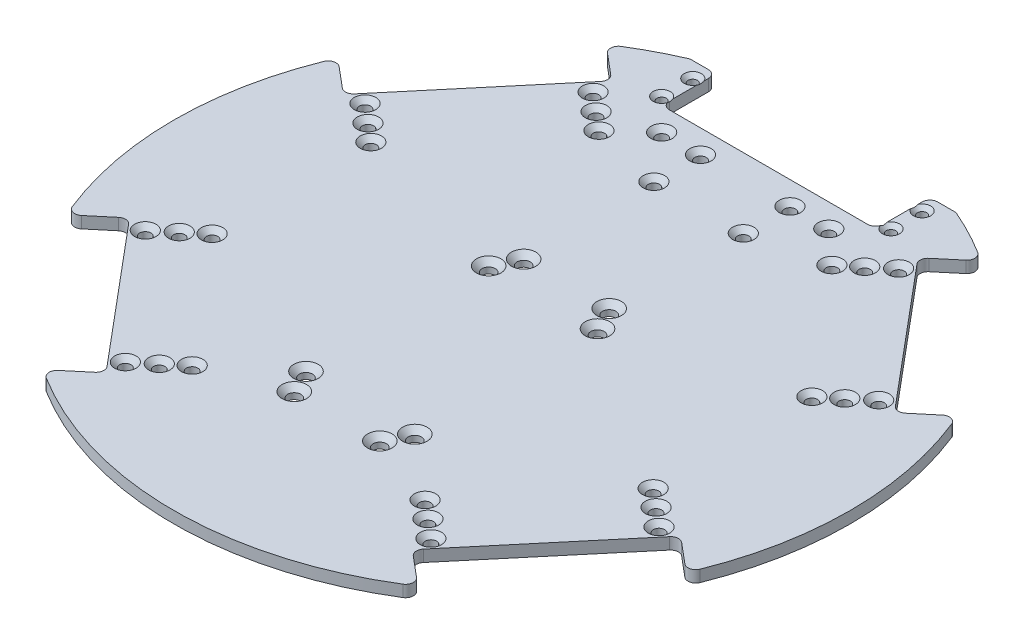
SolidWorks part; units mm, degrees
ref_plane "Plano frontal" through (0, 0, 0) normal (0, 0, 1) x (1, 0, 0)
ref_plane "Plano superior" through (0, 0, 0) normal (0, 1, 0) x (1, 0, 0)
ref_plane "Plano direito" through (0, 0, 0) normal (1, 0, 0) x (0, 0, -1)
sketch "Esboço1" plane through (0, 0, 0) normal (0, 1, 0) x (1, 0, 0)
  line L0 (0, 0) -> (0, 57.579) construction
  line L1 (0, 0) -> (28.8198, 0) construction
  circle A0 centre (0, 0) radius 87
  dimension "D1" = 174
extrude "Ressalto-extrusão2" add sketch "Esboço1" along normal blind 3
sketch "Esboço2" plane through (0, 3, 0) normal (0, 1, 0) x (1, 0, 0)
  line L0 (-87, 0) -> (87, 0) construction
  line L1 (0, 0) -> (66.6459, 55.9225) construction
  line L2 (0, 0) -> (66.6459, -55.9225) construction
  line L3 (48.2004, 72.4274) -> (79.697, 34.8912) construction
  line L4 (39.3908, 65.0353) -> (70.8874, 27.4991)
  line L9 (70.8874, 27.4991) -> (82.3942, 37.1544)
  line L10 (66.6459, 55.9225) -> (82.3942, 37.1544)
  line L11 (66.6459, 55.9225) -> (50.8976, 74.6906)
  line L12 (39.3908, 65.0353) -> (50.8976, 74.6906)
  line L13 (50.8976, -74.6906) -> (82.3942, -37.1544)
  line L14 (50.8976, -74.6906) -> (39.3908, -65.0353)
  line L15 (39.3908, -65.0353) -> (70.8874, -27.4991)
  line L16 (70.8874, -27.4991) -> (82.3942, -37.1544)
  line L17 (0, -87) -> (0, 87) construction
  line L18 (-39.3908, -65.0353) -> (-70.8874, -27.4991)
  line L19 (-50.8976, -74.6906) -> (-82.3942, -37.1544)
  line L20 (-50.8976, -74.6906) -> (-39.3908, -65.0353)
  line L21 (-70.8874, -27.4991) -> (-82.3942, -37.1544)
  line L22 (-66.6459, 55.9225) -> (-82.3942, 37.1544)
  line L23 (-70.8874, 27.4991) -> (-82.3942, 37.1544)
  line L24 (-48.2004, 72.4274) -> (-79.697, 34.8912) construction
  line L25 (-39.3908, 65.0353) -> (-50.8976, 74.6906)
  line L26 (-66.6459, 55.9225) -> (-50.8976, 74.6906)
  line L27 (-39.3908, 65.0353) -> (-70.8874, 27.4991)
  line L28 (48.2004, -72.4274) -> (79.697, -34.8912) construction
  circle A0 centre (0, 0) radius 87 construction
  point P11 (63.9487, 53.6593)
  point P12 (55.1391, 46.2672)
  point P20 (66.6459, -55.9225)
  point P28 (-66.6459, -55.9225)
  dimension "D1" = 40
  dimension "D2" = 40
  dimension "D3" = 49
  dimension "D4" = 11.5
  dimension "D5" = 49
  dimension "D6" = 49
  dimension "D7" = 11.5
extrude "Corte-extrusão2" cut sketch "Esboço2" against normal blind 3
fillet "Filete1" radius 2 16 edges at (-48.2004, 1.5, 72.4274) (-39.3908, 1.5, 65.0353) (-70.8874, 1.5, 27.4991) (-79.697, 1.5, 34.8912) (-79.697, 1.5, -34.8912) (-70.8874, 1.5, -27.4991) (-39.3908, 1.5, -65.0353) (-48.2004, 1.5, -72.4274) (48.2004, 1.5, -72.4274) (39.3908, 1.5, -65.0353) (70.8874, 1.5, -27.4991) (79.697, 1.5, -34.8912) (79.697, 1.5, 34.8912) (70.8874, 1.5, 27.4991) (39.3908, 1.5, 65.0353) (48.2004, 1.5, 72.4274)
sketch "Esboço3" plane through (0, 3, 0) normal (0, 1, 0) x (1, 0, 0)
  line L0 (0, 0) -> (-55.1391, 46.2672) construction
  line L1 (-69.6019, 29.0312) -> (-40.6764, 63.5032) construction
  line L2 (0, 0) -> (-55.1391, -46.2672) construction
  line L4 (-40.6764, -63.5032) -> (-69.6019, -29.0312) construction
  line L6 (0, 87) -> (0, -87) construction
  line L7 (-68.5252, -30.3144) -> (-41.7531, -62.2201) construction
  line L8 (-41.7531, -62.2201) -> (-29.956, -52.3212) construction
  line L9 (-68.5252, -30.3144) -> (-56.7281, -20.4154) construction
  line L10 (-68.5252, 30.3144) -> (-41.7531, 62.2201) construction
  line L11 (-69.6019, 29.0312) -> (-40.6764, 63.5032) construction
  line L12 (-41.7531, 62.2201) -> (-29.956, 52.3212) construction
  line L13 (-68.5252, 30.3144) -> (-56.7281, 20.4154) construction
  line L14 (0, 0) -> (55.1391, -46.2672) construction
  line L15 (68.5252, -30.3144) -> (56.7281, -20.4154) construction
  line L16 (41.7531, -62.2201) -> (29.956, -52.3212) construction
  line L17 (68.5252, -30.3144) -> (41.7531, -62.2201) construction
  line L18 (68.5252, 30.3144) -> (56.7281, 20.4154) construction
  line L19 (41.7531, 62.2201) -> (29.956, 52.3212) construction
  line L20 (68.5252, 30.3144) -> (41.7531, 62.2201) construction
  line L21 (0, 0) -> (55.1391, 46.2672) construction
  arc A0 (45.8895, 73.9131) -> (-45.8895, 73.9131) centre (0, 0) ccw construction
  arc A1 (-45.8895, -73.9131) -> (45.8895, -73.9131) centre (0, 0) ccw construction
  point P16 (-39.3017, -60.1632)
  point P19 (-55.1391, -46.2672)
  point P21 (-34.5523, -56.1779)
  point P22 (-66.0739, -28.2574)
  point P23 (-61.3244, -24.2722)
  point P27 (-66.0739, 28.2574)
  point P28 (-61.3244, 24.2722)
  point P31 (-39.3017, 60.1632)
  point P32 (-34.5523, 56.1779)
  point P39 (-55.1391, 46.2672)
  point P43 (61.3244, -24.2722)
  point P44 (66.0739, -28.2574)
  point P45 (34.5523, -56.1779)
  point P46 (55.1391, -46.2672)
  point P47 (39.3017, -60.1632)
  point P53 (55.1391, 46.2672)
  point P54 (34.5523, 56.1779)
  point P55 (39.3017, 60.1632)
  point P56 (61.3244, 24.2722)
  point P57 (66.0739, 28.2574)
  dimension "D1" = 41.65
  dimension "D2" = 3.2
  dimension "D3" = 6.2
  dimension "D4" = 6
  dimension "D5" = 3.2
  dimension "D6" = 6.2
  dimension "D7" = 6
  dimension "D8" = 41.65
  dimension "D9" = 3.2
  dimension "D10" = 6.2
  dimension "D11" = 6
  dimension "D12" = 3.2
  dimension "D13" = 6.2
  dimension "D14" = 6
hole_wizard "Escareado para parafuso com cabeça escareada chata de M2.51" positions "3DSketch2" profile "Esboço4" countersink size "M2.5" standard "ISO"
sketch3d "3DSketch2"
  point P0 (-66.0739, 3, 28.2574)
  point P3 (-61.3244, 3, 24.2722)
  point P6 (-56.7281, 3, 20.4154)
  point P9 (-39.3017, 3, 60.1632)
  point P12 (-34.5523, 3, 56.1779)
  point P15 (-29.956, 3, 52.3212)
  point P18 (-66.0739, 3, -28.2574)
  point P21 (-61.3244, 3, -24.2722)
  point P24 (-56.7281, 3, -20.4154)
  point P27 (-39.3017, 3, -60.1632)
  point P30 (-34.5523, 3, -56.1779)
  point P33 (-29.956, 3, -52.3212)
  point P36 (39.3017, 3, -60.1632)
  point P39 (34.5523, 3, -56.1779)
  point P42 (29.956, 3, -52.3212)
  point P45 (66.0739, 3, -28.2574)
  point P48 (61.3244, 3, -24.2722)
  point P51 (56.7281, 3, -20.4154)
  point P54 (66.0739, 3, 28.2574)
  point P57 (61.3244, 3, 24.2722)
  point P60 (56.7281, 3, 20.4154)
  point P63 (29.956, 3, 52.3212)
  point P66 (34.5523, 3, 56.1779)
  point P69 (39.3017, 3, 60.1632)
sketch "Esboço4" plane through (-66.0739, 3, 28.2574) normal (1, 0, 0) x (0, 0, 1)
  line L0 (0, 0) -> (0, 3)
  line L1 (0, 3) -> (1.45, 3)
  line L2 (1.45, 3) -> (1.45, 1.3)
  line L3 (1.45, 1.3) -> (2.75, 0)
  line L5 (2.75, 0) -> (0, 0)
  line L6 (-1.45, 1.3) -> (-2.75, 0) construction
  line L11 (0, -6.35) -> (0, 107.95) construction
  dimension "Thru Hole Dia." = 2.9
  dimension "Thru Hole Depth" = 3
  dimension "Near C'Sink Dia." = 5.5
  dimension "Near C'Sink Angle" = 90
sketch "Esboço5" plane through (0, 3, 0) normal (0, 1, 0) x (1, 0, 0)
  line L0 (0, 0) -> (0, 80) construction
  line L1 (0, 80) -> (0, 87) construction
  line L2 (-34.1906, 80) -> (34.1906, 80)
  line L3 (-34.1906, 87) -> (34.1906, 87)
  line L4 (-34.1906, 87) -> (-34.1906, 80)
  line L5 (34.1906, 87) -> (34.1906, 80)
  line L6 (0, 66) -> (27.5, 66)
  line L7 (27.5, 66) -> (27.5, 80)
  line L8 (27.5, 80) -> (-27.5, 80)
  line L9 (-27.5, 80) -> (-27.5, 66)
  line L10 (-27.5, 66) -> (0, 66)
  arc A0 (45.8895, 73.9131) -> (-45.8895, 73.9131) centre (0, 0) ccw construction
  point P10 (0, 80)
  point P13 (0, 87)
  dimension "D1" = 80
  dimension "D2" = 55
  dimension "D3" = 14
extrude "Corte-extrusão3" cut sketch "Esboço5" against normal blind 3 contours L9 L10 L6 L7 L2 | L5 L3 L4 L2
fillet "Filete2" radius 2 6 edges at (-34.1906, 1.5, -80) (27.5, 1.5, -80) (27.5, 1.5, -66) (34.1906, 1.5, -80) (-27.5, 1.5, -66) (-27.5, 1.5, -80)
sketch "Esboço6" plane through (0, 0, 0) normal (0, -1, 0) x (1, 0, 0)
  line L0 (0, 0) -> (0, 87) construction
  line L1 (-12.5, 44) -> (12.5, 44) construction
  point P3 (0, 44)
  point P7 (0, 44)
  dimension "D1" = 87
  dimension "D2" = 43
  dimension "D3" = 25
sketch "Esboço7" plane through (0, 3, 0) normal (0, 1, 0) x (1, 0, 0)
  line L0 (-27.5, 80) -> (-27.5, 66) construction
  line L1 (-33.7787, 80) -> (-29.5, 80) construction
  line L2 (-27.5, 78) -> (-27.5, 68) construction
  line L3 (-25.5, 66) -> (25.5, 66) construction
  line L4 (-27.5, 66) -> (-27.5, 62) construction
  line L5 (-27.5, 62) -> (-19.5, 62) construction
  line L6 (-19.5, 62) -> (-11.5, 62) construction
  line L7 (-19.5, 62) -> (-19.5, 56) construction
  line L8 (-19.5, 56) -> (-11.5, 56) construction
  line L9 (-11.5, 56) -> (-11.5, 62) construction
  line L10 (0, 66) -> (0, 0) construction
  line L11 (11.5, 56) -> (11.5, 62) construction
  line L12 (19.5, 56) -> (11.5, 56) construction
  line L13 (19.5, 62) -> (19.5, 56) construction
  line L14 (19.5, 62) -> (11.5, 62) construction
  dimension "D1" = 4
  dimension "D2" = 8
  dimension "D3" = 8
  dimension "D4" = 6
sketch "Esboço8" plane through (0, 3, 0) normal (0, 1, 0) x (1, 0, 0)
  line L0 (0, 66) -> (0, 60) construction
  line L1 (-25.5, 66) -> (25.5, 66) construction
  line L2 (-27.5, 68) -> (-27.5, 60) construction
  line L3 (27.5, 68) -> (27.5, 60) construction
  line L4 (27.5, 60) -> (0, 60) construction
  line L5 (0, 60) -> (-27.5, 60) construction
  line L6 (-11.5, 60) -> (-11.5, 48) construction
  line L7 (11.5, 60) -> (11.5, 48) construction
  arc A0 (-27.5, 68) -> (-25.5, 66) centre (-25.5, 68) ccw construction
  point P13 (-16.5, 60)
  point P14 (21.5, 60)
  point P16 (16.5, 60)
  point P17 (-21.5, 60)
  point P18 (-11.5, 60)
  point P19 (11.5, 60)
  point P24 (-11.5, 54)
  point P25 (11.5, 54)
  dimension "D1" = 6
  dimension "D2" = 6
  dimension "D3" = 5
  dimension "D4" = 5
  dimension "D5" = 6
  dimension "D6" = 5
  dimension "D7" = 5
  dimension "D8" = 6
  dimension "D9" = 6
  dimension "D10" = 6
  dimension "D11" = 6
hole_wizard "Escareado para parafuso com cabeça escareada chata de M2.52" positions "3DSketch5" profile "Esboço11" countersink size "M2.5" standard "ISO"
sketch3d "3DSketch5"
  point P0 (-21.5, 3, -60)
  point P3 (-11.5, 3, -60)
  point P6 (-11.5, 3, -48)
  point P9 (11.5, 3, -48)
  point P12 (11.5, 3, -60)
  point P15 (21.5, 3, -60)
sketch "Esboço11" plane through (-21.5, 3, -60) normal (1, 0, 0) x (0, 0, 1)
  line L0 (0, 0) -> (0, 8.1212)
  line L1 (0, 8.1212) -> (1.45, 7.25)
  line L2 (1.45, 7.25) -> (1.45, 1.3)
  line L3 (1.45, 1.3) -> (2.75, 0)
  line L5 (2.75, 0) -> (0, 0)
  line L6 (-1.45, 1.3) -> (-2.75, 0) construction
  line L10 (0, 8.1212) -> (-1.45, 7.25) construction
  line L11 (0, -6.35) -> (0, 107.95) construction
  dimension "Hole Dia." = 2.9
  dimension "Hole Depth" = 7.25
  dimension "Near C'Sink Dia." = 5.5
  dimension "Near C'Sink Angle" = 90
  dimension "Drill Angle" = 118
sketch "Esboço12" plane through (0, 3, 0) normal (0, 1, 0) x (1, 0, 0)
  line L0 (0, 0) -> (0, -87) construction
  line L1 (0, 0) -> (0, 66) construction
  line L2 (-25.5, 66) -> (25.5, 66) construction
  line L3 (-11, 14) -> (11, 14) construction
  line L4 (-11, -45) -> (11, -45) construction
  line L5 (-14, -39) -> (14, -39)
  line L6 (-14, 8) -> (14, 8)
  arc A0 (-45.8895, -73.9131) -> (45.8895, -73.9131) centre (0, 0) ccw construction
  point P6 (0, -45)
  point P7 (0, 14)
  point P14 (0, 14)
  point P17 (0, -45)
  point P21 (0, -39)
  point P23 (0, 8)
  dimension "D1" = 42
  dimension "D2" = 59
  dimension "D3" = 22
  dimension "D4" = 22
  dimension "D5" = 28
  dimension "D6" = 6
  dimension "D7" = 28
  dimension "D8" = 6
hole_wizard "Escareado para parafuso com cabeça escareada chata de M31" positions "3DSketch6" profile "Esboço13" countersink size "M3" standard "ISO"
sketch3d "3DSketch6"
  point P0 (11, 3, -14)
  point P3 (-11, 3, -14)
  point P6 (-11, 3, 45)
  point P9 (11, 3, 45)
  point P12 (-14, 3, 39)
  point P15 (14, 3, 39)
  point P19 (-14, 3, -8)
  point P22 (14, 3, -8)
sketch "Esboço13" plane through (11, 3, -14) normal (1, 0, 0) x (0, 0, 1)
  line L0 (0, 0) -> (0, 8.2715)
  line L1 (0, 8.2715) -> (1.7, 7.25)
  line L2 (1.7, 7.25) -> (1.7, 1.45)
  line L3 (1.7, 1.45) -> (3.15, 0)
  line L5 (3.15, 0) -> (0, 0)
  line L6 (-1.7, 1.45) -> (-3.15, 0) construction
  line L10 (0, 8.2715) -> (-1.7, 7.25) construction
  line L11 (0, -6.35) -> (0, 107.95) construction
  dimension "Hole Dia." = 3.4
  dimension "Hole Depth" = 7.25
  dimension "Near C'Sink Dia." = 6.3
  dimension "Near C'Sink Angle" = 90
  dimension "Drill Angle" = 118
sketch "Esboço14" plane through (0, 3, 0) normal (0, 1, 0) x (1, 0, 0)
  line L0 (-27.5, 78) -> (-27.5, 68) construction
  line L1 (29.5, 80) -> (29.5, 65) construction
  line L2 (-29.5, 80) -> (-29.5, 65) construction
  line L3 (-33.7787, 80) -> (-29.5, 80) construction
  line L4 (29.5, 80) -> (33.7787, 80) construction
  line L5 (27.5, 68) -> (27.5, 78) construction
  point P6 (-29.5, 72)
  point P7 (-29.5, 76)
  point P8 (-29.5, 68)
  point P15 (29.5, 76)
  point P16 (29.5, 72)
  point P17 (29.5, 68)
  dimension "D1" = 2
  dimension "D2" = 15
  dimension "D3" = 4
  dimension "D4" = 4
  dimension "D5" = 4
  dimension "D6" = 2
  dimension "D7" = 15
  dimension "D8" = 4
  dimension "D9" = 4
  dimension "D10" = 4
hole_wizard "Escareado para parafuso com cabeça escareada chata de M21" positions "3DSketch10" profile "Esboço17" countersink size "M2" standard "ISO"
sketch3d "3DSketch10"
  point P0 (-29.5, 3, -76)
  point P6 (-29.5, 3, -68)
  point P9 (29.5, 3, -76)
  point P15 (29.5, 3, -68)
sketch "Esboço17" plane through (-29.5, 3, -76) normal (1, 0, 0) x (0, 0, 1)
  line L0 (0, 0) -> (0, 10.721)
  line L1 (0, 10.721) -> (1.2, 10)
  line L2 (1.2, 10) -> (1.2, 1)
  line L3 (1.2, 1) -> (2.2, 0)
  line L5 (2.2, 0) -> (0, 0)
  line L6 (-1.2, 1) -> (-2.2, 0) construction
  line L10 (0, 10.721) -> (-1.2, 10) construction
  line L11 (0, -6.35) -> (0, 107.95) construction
  dimension "Hole Dia." = 2.4
  dimension "Hole Depth" = 10
  dimension "Near C'Sink Dia." = 4.4
  dimension "Near C'Sink Angle" = 90
  dimension "Drill Angle" = 118
